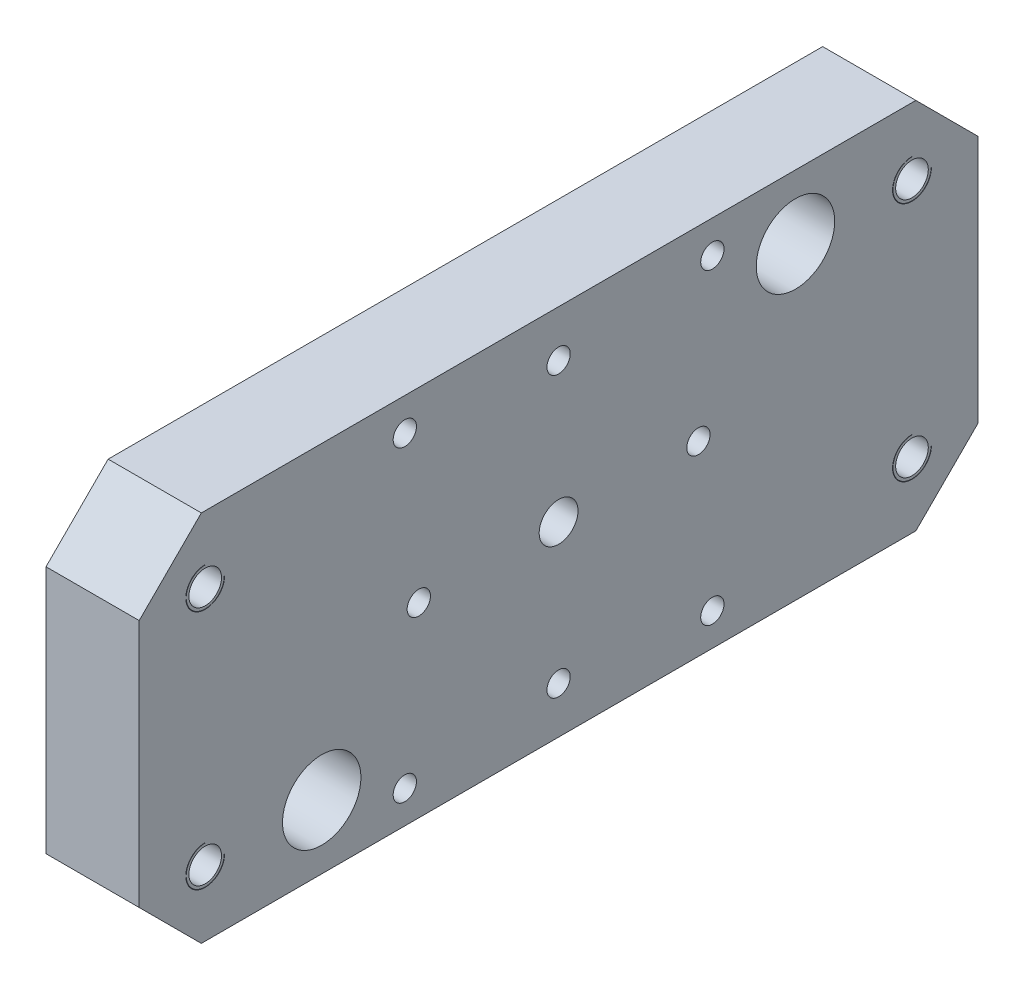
SolidWorks part; units mm, degrees
ref_plane "Plan de face" through (0, 0, 0) normal (0, 0, 1) x (1, 0, 0)
ref_plane "Plan de dessus" through (0, 0, 0) normal (0, 1, 0) x (1, 0, 0)
ref_plane "Plan de droite" through (0, 0, 0) normal (1, 0, 0) x (0, 0, -1)
imported_body "Importée1"
sketch "Esquisse1" plane through (-32, 0, 0) normal (1, 0, 0) x (0, 0, -1)
  circle A0 centre (19.799, 19.799) radius 1.5
  circle A1 centre (18, 0) radius 1.5
  circle A2 centre (19.799, -19.799) radius 1.5
  dimension "D1" = 3
  dimension "D2" = 3
extrude "Enlèv. mat.-Extru.1" cut sketch "Esquisse1" against normal through all
sketch "Esquisse2" plane through (-32, 0, 0) normal (1, 0, 0) x (0, 0, -1)
  circle A0 centre (0, -18) radius 1.5
  circle A1 centre (-19.799, -19.799) radius 1.5
  circle A2 centre (-19.799, 19.799) radius 1.5
  circle A3 centre (-18, 0) radius 1.5
  circle A6 centre (0, 18) radius 1.5
  circle A7 centre (0, 0) radius 2.5
  dimension "D1" = 3
  dimension "D2" = 3
  dimension "D3" = 3
  dimension "D5" = 5
  dimension "D4" = 18
extrude "Enlèv. mat.-Extru.2" cut sketch "Esquisse2" against normal through all
sketch "Esquisse5" plane through (-44, 0, 0) normal (-1, 0, 0) x (0, 0, 1)
  circle A0 centre (0, 0) radius 5.25
  circle A1 centre (18, 0) radius 3.25
  circle A2 centre (19.799, 19.799) radius 3.25
  circle A3 centre (19.799, -19.799) radius 3.25
  circle A4 centre (0, -18) radius 3.25
  circle A5 centre (-19.799, -19.799) radius 3.25
  circle A6 centre (-18, 0) radius 3.25
  circle A7 centre (0, 18) radius 3.25
  circle A8 centre (-19.799, 19.799) radius 3.25
  dimension "D1" = 6.5
  dimension "D2" = 10.5
extrude "Extrusion2" cut sketch "Esquisse5" against normal blind 3
